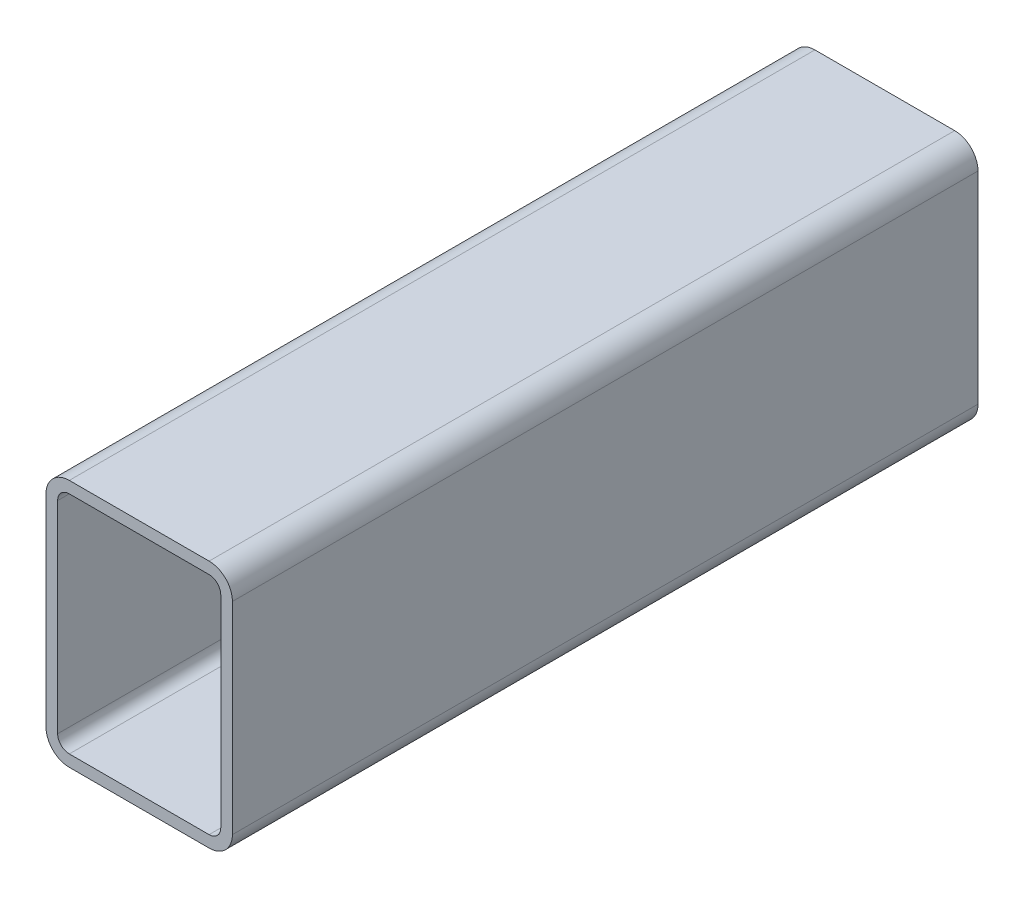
SolidWorks part; units mm, degrees
ref_plane "Front Plane" through (0, 0, 0) normal (0, 0, 1) x (1, 0, 0)
ref_plane "Top Plane" through (0, 0, 0) normal (0, 1, 0) x (1, 0, 0)
ref_plane "Right Plane" through (0, 0, 0) normal (1, 0, 0) x (0, 0, -1)
sketch "Sketch1" plane through (0, 0, 0) normal (0, 0, 1) x (1, 0, 0)
sketch_block_instance "HSS4x3x0.1875-1"
sketch_block "HSS4x3x0.1875"
extrude "Boss-Extrude1" add sketch "Sketch1" along normal blind 304.8
